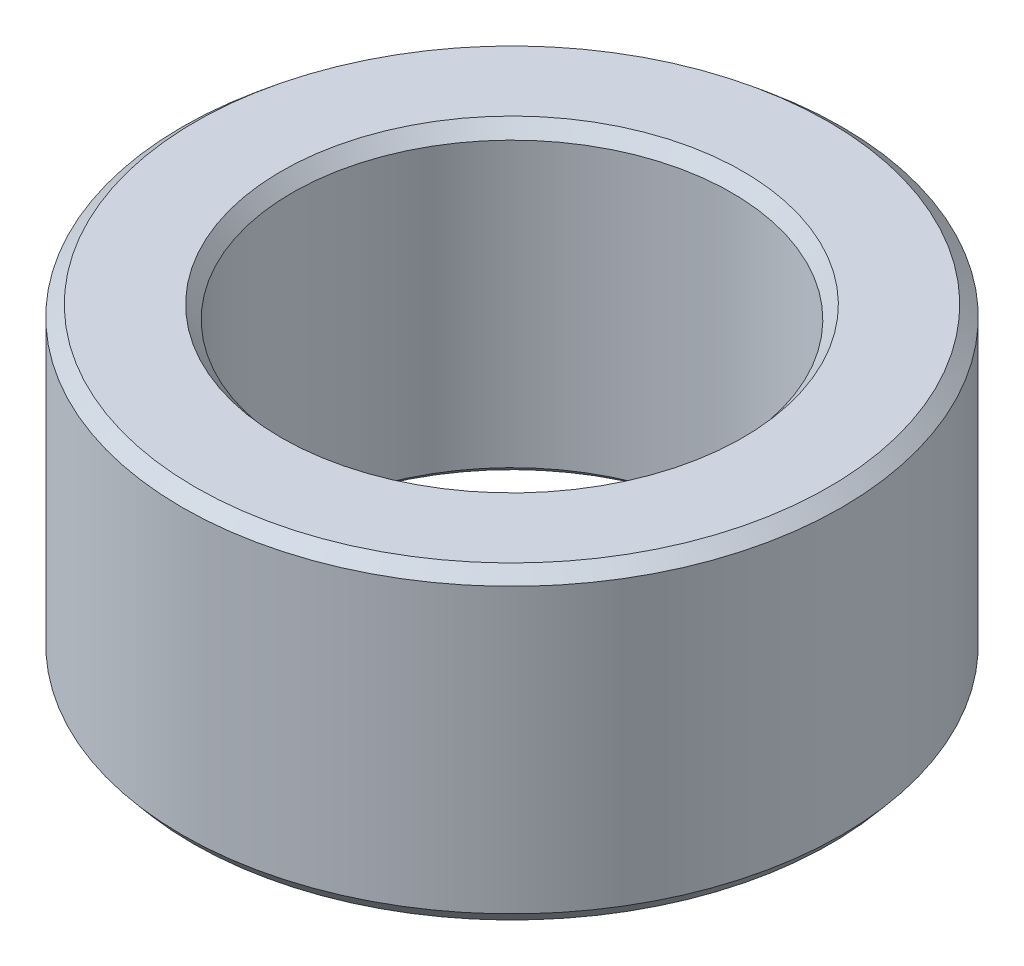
SolidWorks part; units mm, degrees
ref_plane "Front" through (0, 0, 0) normal (0, 0, 1) x (1, 0, 0)
ref_plane "Top" through (0, 0, 0) normal (0, 1, 0) x (1, 0, 0)
ref_plane "Right" through (0, 0, 0) normal (1, 0, 0) x (0, 0, -1)
sketch "Sketch1" plane through (0, 0, 0) normal (0, 1, 0) x (1, 0, 0)
  circle A0 centre (0, 0) radius 15
  circle A1 centre (0, 0) radius 10
  dimension "D1" = 30
  dimension "D2" = 20
extrude "Boss-Extrude1" add sketch "Sketch1" along normal mid plane 14
chamfer "Chamfer1" distance 0.5 angle 50 4 edges at (0, -7, 15) (0, 7, 15) (0, 7, 10) (0, -7, 10)
